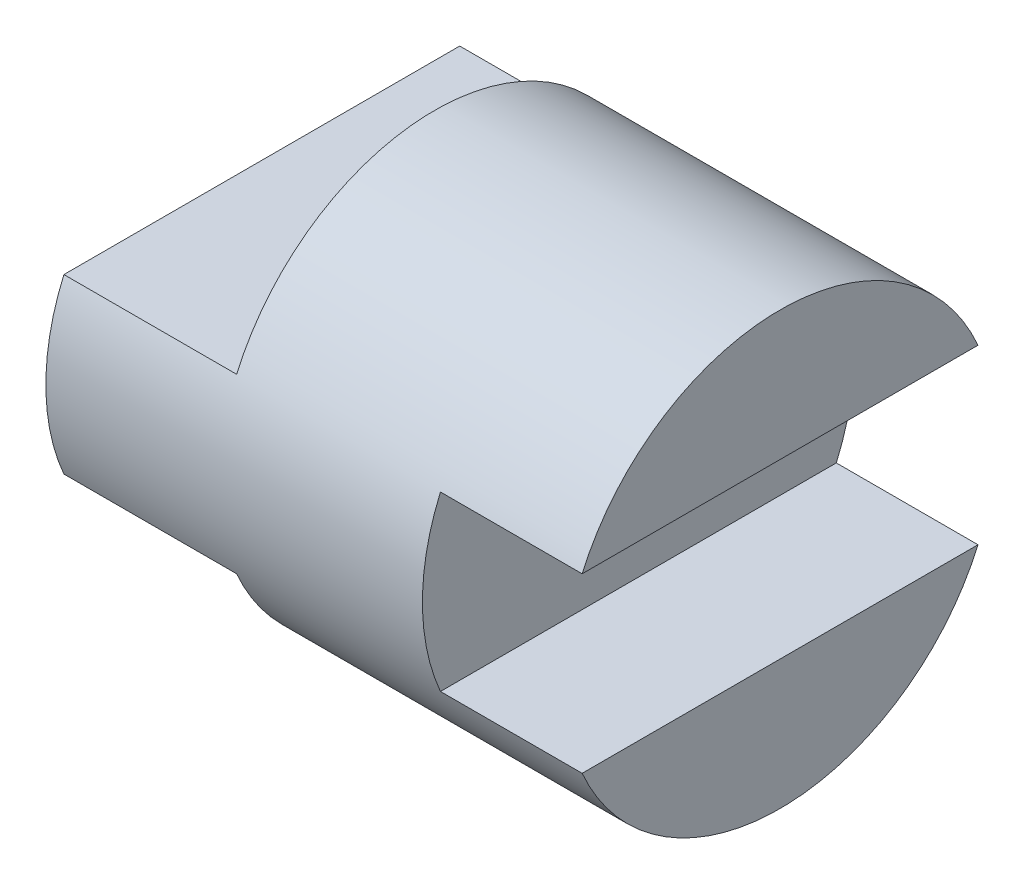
SolidWorks part; units mm, degrees
ref_plane "前视基准面" through (0, 0, 0) normal (0, 0, 1) x (1, 0, 0)
ref_plane "上视基准面" through (0, 0, 0) normal (0, 1, 0) x (1, 0, 0)
ref_plane "右视基准面" through (0, 0, 0) normal (1, 0, 0) x (0, 0, -1)
sketch "草图2" plane through (0, 0, 0) normal (1, 0, 0) x (0, 0, -1)
  circle A0 centre (0, 0) radius 50
extrude "拉伸1" add sketch "草图2" along normal blind 120
sketch "草图3" plane through (0, 0, 0) normal (-1, 0, 0) x (0, 0, 1)
  line L0 (0, 0) -> (-65.6975, 0) construction
  line L1 (52.8886, -52.8488) -> (52.8886, -20)
  line L2 (-58.2601, 52.8488) -> (52.8886, 52.8488)
  line L3 (-58.2601, 52.8488) -> (-58.2601, 20)
  line L4 (-58.2601, 20) -> (52.8886, 20)
  line L5 (52.8886, 52.8488) -> (52.8886, 20)
  line L6 (-58.2601, -20) -> (52.8886, -20)
  line L7 (-58.2601, -52.8488) -> (-58.2601, -20)
  line L8 (-58.2601, -52.8488) -> (52.8886, -52.8488)
  dimension "D1" = 20
extrude "切除-拉伸1" cut sketch "草图3" against normal blind 40
sketch "草图4" plane through (0, 0, 0) normal (0, 0, 1) x (1, 0, 0)
  line L0 (0, 0) -> (160.7119, 0) construction
  line L2 (160.7119, 20) -> (87.1909, 20)
  line L3 (160.7119, 20) -> (160.7119, -20)
  line L4 (160.7119, -20) -> (87.1909, -20)
  line L5 (87.1909, 20) -> (87.1909, -20)
extrude "切除-拉伸2" cut sketch "草图4" against normal mid plane 100
